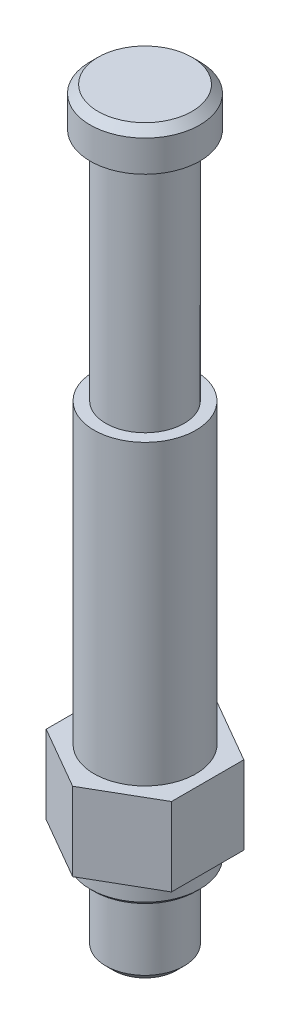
SolidWorks part; units mm, degrees
ref_plane "Plan de face" through (0, 0, 0) normal (0, 0, 1) x (1, 0, 0)
ref_plane "Plan de dessus" through (0, 0, 0) normal (0, 1, 0) x (1, 0, 0)
ref_plane "Plan de droite" through (0, 0, 0) normal (1, 0, 0) x (0, 0, -1)
sketch "Esquisse1" plane through (0, 0, 0) normal (0, 0, 1) x (1, 0, 0)
  line L0 (0, 0) -> (0, 23.7742) construction
  line L1 (0, 96) -> (-7, 96)
  line L2 (-7, 96) -> (-7, 91)
  line L3 (-7, 91) -> (-5, 91)
  line L4 (-5, 91) -> (-5, 61)
  line L5 (-5, 61) -> (-6.5, 61)
  line L6 (-6.5, 61) -> (-6.5, 23)
  line L7 (-6.5, 23) -> (-10, 23)
  line L8 (-10, 23) -> (-10, 13)
  line L9 (-10, 13) -> (-7, 13)
  line L10 (-5, 10) -> (-5, 0)
  line L11 (-5, 0) -> (0, 0)
  line L12 (-7, 13) -> (-7, 10)
  line L13 (-7, 10) -> (-5, 10)
  line L14 (0, 0) -> (0, 96)
  dimension "D1" = 14
  dimension "D2" = 5
  dimension "D3" = 96
  dimension "D4" = 10
  dimension "D5" = 35
  dimension "D6" = 13
  dimension "D7" = 20
  dimension "D8" = 10
  dimension "D9" = 10
  dimension "D10" = 14
  dimension "D11" = 3
  dimension "D12" = 10
revolve "Révolution2" add sketch "Esquisse1" angle 360 about L14
chamfer "Chanfrein1" distance 1 angle 45 2 edges at (0, 0, -5) (0, 96, -7)
chamfer "Chanfrein2" distance 0.5 angle 45 1 edges at (0, 10, -7)
sketch "Esquisse3" plane through (0, 0, 0) normal (0, 0, 1) x (1, 0, 0)
  line L1 (-17.4944, 33.9017) -> (-8, 33.9017)
  line L2 (-17.4944, 33.9017) -> (-17.4944, 11.3489)
  line L3 (-17.4944, 11.3489) -> (-8, 11.3489)
  line L4 (-8, 33.9017) -> (-8, 11.3489)
  dimension "D1" = 8
extrude "Enlèv. mat.-Extru.1" cut sketch "Esquisse3" against normal through all and the other way through all
pattern_circular "Répétition circulaire1" count 6 every 60 about axis through (0, 0, 0) along (0, 1, 0) of "Enlèv. mat.-Extru.1"
